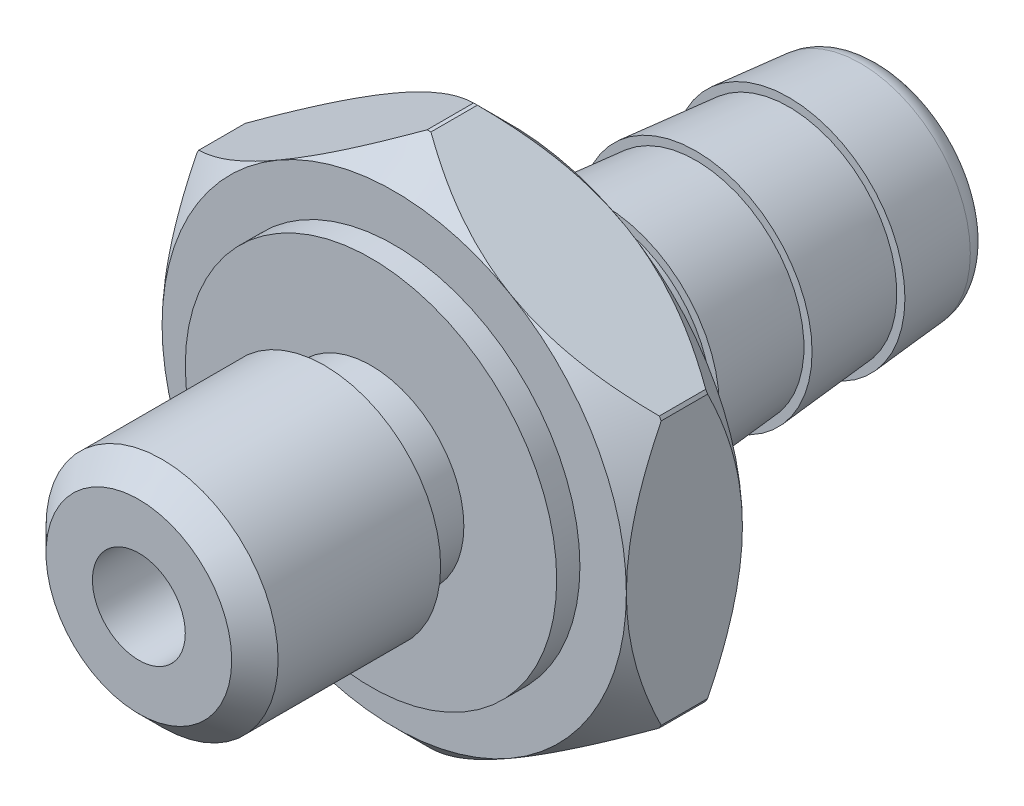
SolidWorks part; units mm, degrees
ref_plane "Plan1" through (0, 0, 0) normal (0, 0, 1) x (1, 0, 0)
ref_plane "Plan2" through (0, 0, 0) normal (0, 1, 0) x (1, 0, 0)
ref_plane "Plan3" through (0, 0, 0) normal (1, 0, 0) x (0, 0, -1)
sketch "Esquisse1" plane through (0, 0, 0) normal (0, 0, 1) x (1, 0, 0)
  circle A0 centre (0, 0) radius 5.75
  dimension "D1" = 11.5
extrude "Base-Extrusion" add sketch "Esquisse1" along normal blind 2.5
chamfer "Chanfrein1" distance 0.75 angle 45
sketch "Esquisse2" plane through (0, 0, 2.5) normal (0, 0, 1) x (1, 0, 0)
  line L0 (0, 10) -> (0, -10) construction
  line L1 (5, 10) -> (8, 10)
  line L2 (5, 10) -> (5, -10)
  line L3 (5, -10) -> (8, -10)
  line L4 (8, 10) -> (8, -10)
  line L5 (-5, -10) -> (-8, -10)
  line L6 (-8, 10) -> (-8, -10)
  line L7 (-5, 10) -> (-8, 10)
  line L8 (-5, 10) -> (-5, -10)
  dimension "D1" = 5
  dimension "D2" = 3
extrude "Enlèv. mat.-Extru.1" cut sketch "Esquisse2" against normal through all
sketch "Esquisse3" plane through (0, 0, 2.5) normal (0, 0, 1) x (1, 0, 0)
  line L0 (6.8551, 1.8157) -> (0, 5.7735)
  line L1 (6.8551, 1.8157) -> (10.0258, 7.3075)
  line L2 (-6.8551, 1.8157) -> (-10.0258, 7.3075)
  line L3 (1.3656, 12.3075) -> (0.2074, 10.3014)
  line L4 (1.3656, 12.3075) -> (10.0258, 7.3075)
  line L5 (-10, 0) -> (10, 0) construction
  line L6 (0, 7.0525) -> (0, -10) construction
  line L7 (-1.3656, 12.3075) -> (-10.0258, 7.3075)
  line L8 (-6.8551, 1.8157) -> (0, 5.7735)
  line L9 (-1.3656, 12.3075) -> (0.2074, 10.3014)
  line L10 (6.8551, -1.8157) -> (10.0258, -7.3075)
  line L11 (6.8551, -1.8157) -> (0, -5.7735)
  line L12 (1.3656, -12.3075) -> (0, -10.4364)
  line L13 (1.3656, -12.3075) -> (10.0258, -7.3075)
  line L14 (-1.3656, -12.3075) -> (0, -10.4364)
  line L15 (-1.3656, -12.3075) -> (-10.0258, -7.3075)
  line L16 (-6.8551, -1.8157) -> (-10.0258, -7.3075)
  line L17 (-6.8551, -1.8157) -> (0, -5.7735)
  dimension "D1" = 10
  dimension "D2" = 10
  dimension "D3" = 60
extrude "Enlèv. mat.-Extru.2" cut sketch "Esquisse3" against normal through all
sketch "Esquisse4" plane through (0, 0, 2.5) normal (0, 0, 1) x (1, 0, 0)
  circle A0 centre (0, 0) radius 4
  dimension "D1" = 8
extrude "Boss.-Extru.1" add sketch "Esquisse4" along normal blind 0.5
sketch "Esquisse5" plane through (0, 0, 3) normal (0, 0, 1) x (1, 0, 0)
  circle A0 centre (0, 0) radius 2
  dimension "D1" = 4
extrude "Boss.-Extru.2" add sketch "Esquisse5" along normal blind 1
sketch "Esquisse6" plane through (0, 0, 4) normal (0, 0, 1) x (1, 0, 0)
  circle A0 centre (0, 0) radius 2.5
  dimension "D1" = 5
extrude "Boss.-Extru.3" add sketch "Esquisse6" along normal blind 4
chamfer "Chanfrein2" distance 0.5 angle 45
sketch "Esquisse7" plane through (0, 0, 0) normal (0, 0, -1) x (-1, 0, 0)
  circle A0 centre (0, 0) radius 2.5
  dimension "D1" = 5
extrude "Boss.-Extru.4" add sketch "Esquisse7" along normal blind 2 draft 5
pattern_linear "Répétition linéaire1" count 4 spacing 2
fillet "Congé1" radius 0.5
sketch "Esquisse8" plane through (0, 0, 8) normal (0, 0, 1) x (1, 0, 0)
  circle A0 centre (0, 0) radius 1
  dimension "D1" = 2
extrude "Enlèv. mat.-Extru.3" cut sketch "Esquisse8" against normal through all
